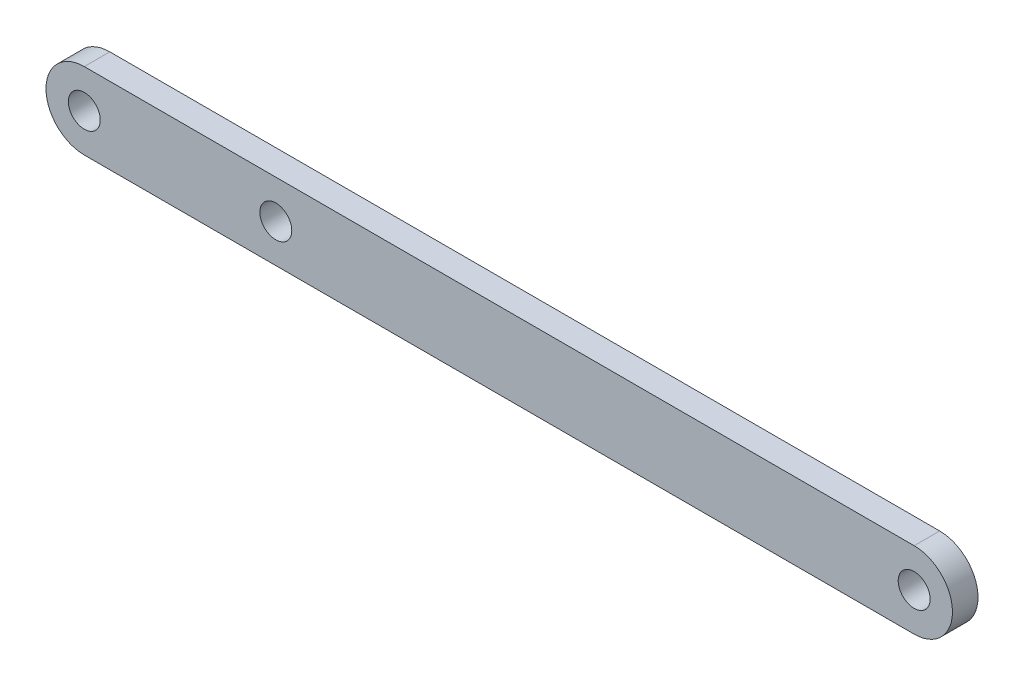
SolidWorks part; units mm, degrees
ref_plane "前视基准面" through (0, 0, 0) normal (0, 0, 1) x (1, 0, 0)
ref_plane "上视基准面" through (0, 0, 0) normal (0, 1, 0) x (1, 0, 0)
ref_plane "右视基准面" through (0, 0, 0) normal (1, 0, 0) x (0, 0, -1)
sketch "草图1" plane through (0, 0, 0) normal (0, 0, 1) x (1, 0, 0)
  line L0 (-50, 0) -> (-47.5, 0) construction
  line L1 (-50, 6) -> (50, 6)
  line L2 (-50, -6) -> (50, -6)
  line L3 (-77.5, 0) -> (-80, 0)
  line L4 (-80, 6) -> (-50, 6)
  line L5 (-80, -6) -> (-50, -6)
  line L6 (47.5, 0) -> (50, 0) construction
  circle A0 centre (-50, 0) radius 2.5
  arc A1 (50, -6) -> (50, 6) centre (50, 0) ccw
  circle A3 centre (50, 0) radius 2.5
  circle A4 centre (-80, 0) radius 2.5
  arc A5 (-80, 6) -> (-80, -6) centre (-80, 0) ccw
  point P2 (0, 0)
extrude "凸台-拉伸1" add sketch "草图1" along normal blind 4 contours L4 A5 L5 L2 A1 L1 A0 A3 A4
